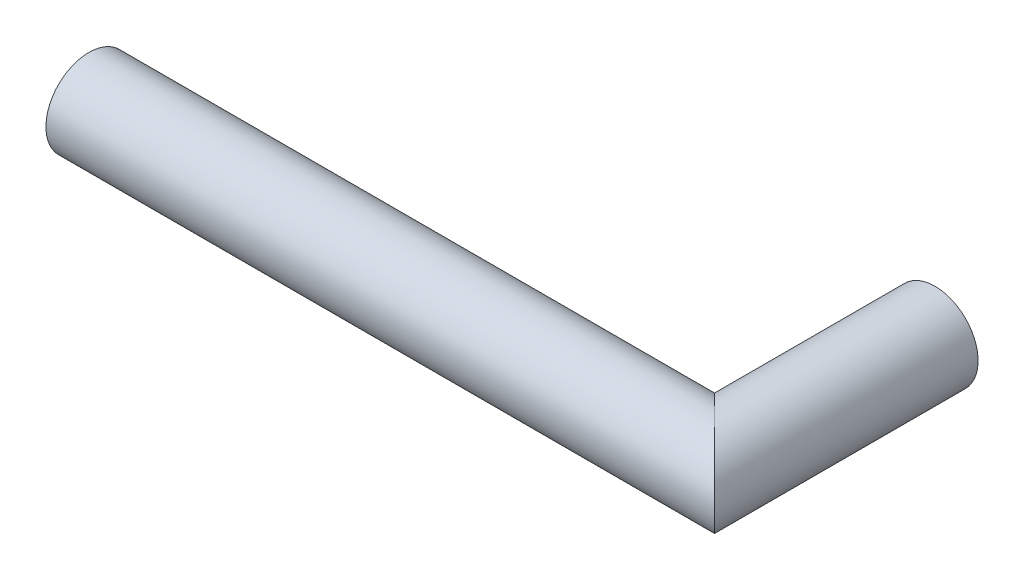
SolidWorks part; units mm, degrees
ref_plane "Alzado" through (0, 0, 0) normal (0, 0, 1) x (1, 0, 0)
ref_plane "Planta" through (0, 0, 0) normal (0, 1, 0) x (1, 0, 0)
ref_plane "Vista lateral" through (0, 0, 0) normal (1, 0, 0) x (0, 0, -1)
sketch "Croquis1" plane through (0, 0, 0) normal (0, 1, 0) x (1, 0, 0)
  line L0 (0, 0) -> (87.25, 0)
  line L1 (87.25, 0) -> (87.25, 30.7513)
  dimension "D1" = 87.25
sketch "Croquis2" plane through (0, 0, 0) normal (1, 0, 0) x (0, 0, -1)
  circle A0 centre (0, 0) radius 6
  circle A1 centre (0, 0) radius 5
  dimension "D1" = 12
  dimension "D2" = 10
sweep "Barrer2" add profiles "Croquis2" path "Croquis1"
